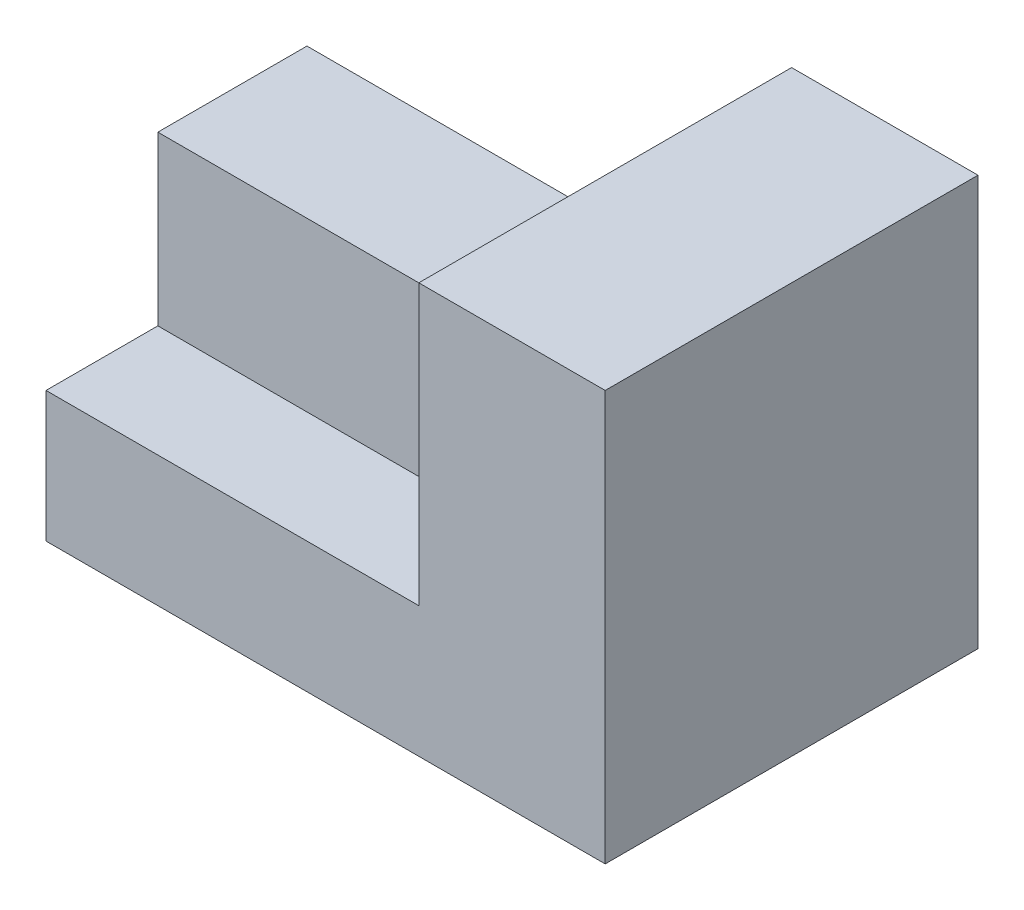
SolidWorks part; units mm, degrees
ref_plane "前视基准面" through (0, 0, 0) normal (0, 0, 1) x (1, 0, 0)
ref_plane "上视基准面" through (0, 0, 0) normal (0, 1, 0) x (1, 0, 0)
ref_plane "右视基准面" through (0, 0, 0) normal (1, 0, 0) x (0, 0, -1)
sketch "草图1" plane through (0, 0, 0) normal (0, 0, 1) x (1, 0, 0)
  line L0 (0, 0) -> (30, 0)
  line L1 (30, 0) -> (30, 22)
  line L2 (30, 22) -> (20, 22)
  line L3 (20, 22) -> (20, 16)
  line L4 (20, 16) -> (0, 16)
  line L5 (0, 16) -> (0, 0)
extrude "拉伸1" add sketch "草图1" along normal mid plane 20
sketch "草图2" plane through (0, 16, 0) normal (0, 1, 0) x (1, 0, 0)
  line L0 (20, -10) -> (20, 10) construction
  line L1 (-1.1877, -4) -> (20, -4)
  line L2 (-1.1877, -4) -> (-1.1877, -12.908)
  line L3 (-1.1877, -12.908) -> (20, -12.908)
  line L4 (20, -4) -> (20, -12.908)
  line L5 (20, -10) -> (0, -10) construction
  dimension "D1" = 6
extrude "切除-拉伸1" cut sketch "草图2" against normal blind 9
mirror "镜向1" about plane through (0, 0, 0) normal (0, 0, 1) of "切除-拉伸1"
